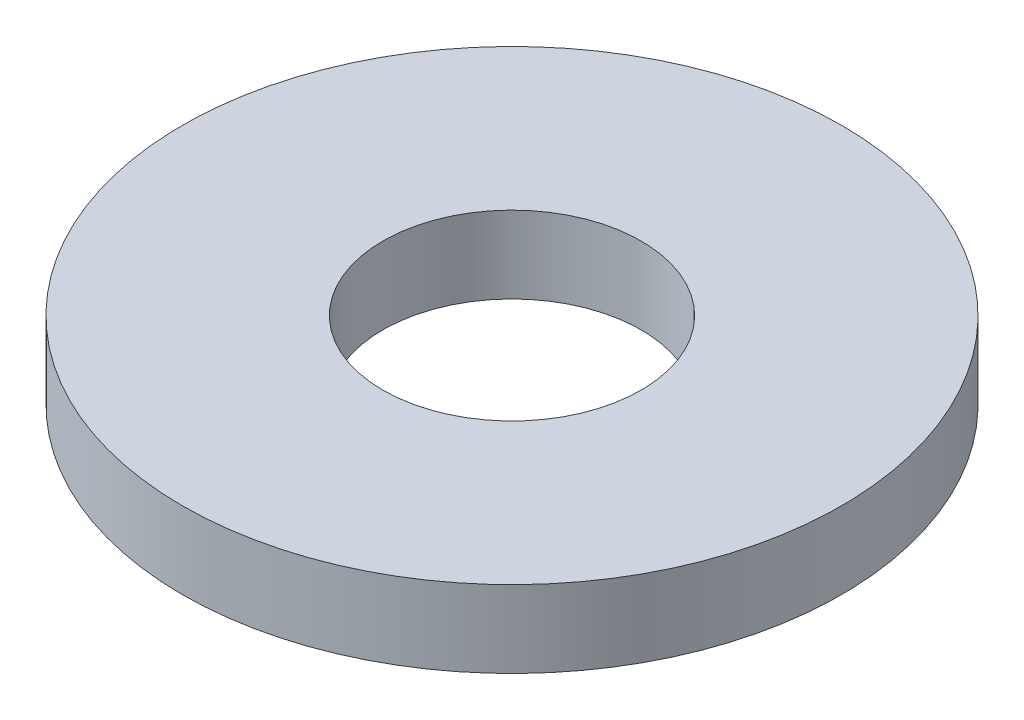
SolidWorks part; units mm, degrees
ref_plane "Front Plane" through (0, 0, 0) normal (0, 0, 1) x (1, 0, 0)
ref_plane "Top Plane" through (0, 0, 0) normal (0, 1, 0) x (1, 0, 0)
ref_plane "Right Plane" through (0, 0, 0) normal (1, 0, 0) x (0, 0, -1)
sketch "Sketch1" plane through (0, 0, 0) normal (0, 1, 0) x (1, 0, 0)
  circle A0 centre (0, 0) radius 2.3495
  circle A1 centre (0, 0) radius 5.9944
  dimension "D1" = 11.9888
  dimension "D2" = 4.699
extrude "Boss-Extrude1" add sketch "Sketch1" along normal blind 1.4
